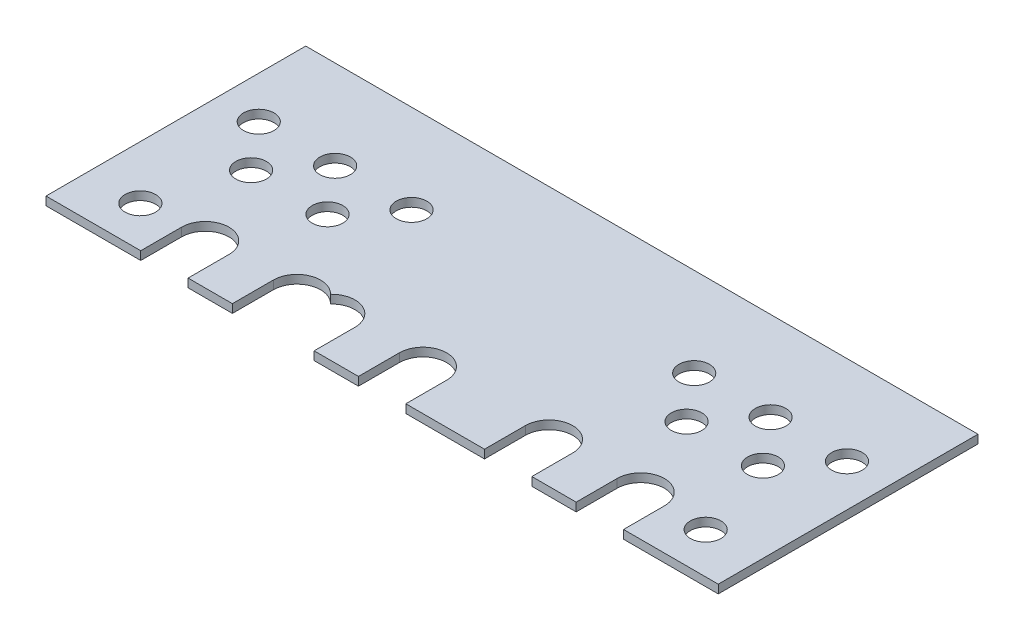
SolidWorks part; units mm, degrees
ref_plane "Front Plane" through (0, 0, 0) normal (0, 0, 1) x (1, 0, 0)
ref_plane "Top Plane" through (0, 0, 0) normal (0, 1, 0) x (1, 0, 0)
ref_plane "Right Plane" through (0, 0, 0) normal (1, 0, 0) x (0, 0, -1)
sketch "Sketch1" plane through (0, 0, 0) normal (0, 1, 0) x (1, 0, 0)
  line L1 (44, -17) -> (-44, -17)
  line L2 (44, -17) -> (44, 17)
  line L3 (44, 17) -> (-44, 17)
  line L4 (-44, -17) -> (-44, 17)
  line L5 (44, -17) -> (-44, 17) construction
  line L6 (44, 17) -> (-44, -17) construction
  point P0 (0, 0)
  dimension "D1" = 88
  dimension "D2" = 34
extrude "Boss-Extrude1" add sketch "Sketch1" along normal blind 1.11
sketch "Sketch2" plane through (0, 1.11, 0) normal (0, 1, 0) x (1, 0, 0)
  line L0 (-44, 5.35) -> (44, 5.35) construction
  line L1 (-44, 17) -> (-44, -17) construction
  line L2 (44, -17) -> (44, 17) construction
  line L3 (44, -0.65) -> (-44, -0.65) construction
  line L4 (-44, -17) -> (44, -17) construction
  line L5 (-33.5, -0.65) -> (-33.5, 5.35) construction
  line L6 (-38.5, 5.35) -> (-28.5, 5.35) construction
  line L7 (28.5, 5.35) -> (38.5, 5.35) construction
  line L8 (33.5, 5.35) -> (33.5, -0.65) construction
  circle A0 centre (-38.5, 5.35) radius 2
  circle A1 centre (-28.5, 5.35) radius 2
  circle A2 centre (-18.5, 5.35) radius 2
  circle A3 centre (-33.5, -0.65) radius 2
  circle A4 centre (-23.5, -0.65) radius 2
  circle A6 centre (18.5, 5.35) radius 2
  circle A7 centre (28.5, 5.35) radius 2
  circle A8 centre (38.5, 5.35) radius 2
  circle A9 centre (23.5, -0.65) radius 2
  circle A10 centre (33.5, -0.65) radius 2
  dimension "D1" = 4
  dimension "D2" = 4
  dimension "D3" = 4
  dimension "D4" = 4
  dimension "D5" = 4
  dimension "D6" = 4
  dimension "D7" = 4
  dimension "D8" = 4
  dimension "D9" = 4
  dimension "D10" = 4
  dimension "D11" = 6
  dimension "D12" = 10
  dimension "D13" = 10
  dimension "D14" = 10
  dimension "D15" = 10
  dimension "D16" = 10
  dimension "D17" = 10
  dimension "D18" = 10.5
  dimension "D19" = 10.5
  dimension "D20" = 16.35
extrude "Cut-Extrude1" cut sketch "Sketch2" against normal through all
sketch "Sketch3" plane through (0, 1.11, 0) normal (0, 1, 0) x (1, 0, 0)
  line L0 (44, -17) -> (44, 17) construction
  line L1 (-44, 17) -> (-44, -17) construction
  line L2 (-44, -17) -> (44, -17) construction
  circle A0 centre (-37, -11.65) radius 2
  circle A1 centre (37, -11.65) radius 2
  dimension "D1" = 4
  dimension "D2" = 4
  dimension "D3" = 7
  dimension "D4" = 7
  dimension "D5" = 5.35
  dimension "D6" = 5.35
extrude "Cut-Extrude2" cut sketch "Sketch3" against normal through all
sketch "Sketch4" plane through (0, 1.11, 0) normal (0, 1, 0) x (1, 0, 0)
  line L0 (-31.6, -11.65) -> (-31.6, -17)
  line L1 (-44, -17) -> (44, -17) construction
  line L2 (-31.6, -17) -> (-25.4, -17)
  line L3 (-25.4, -17) -> (-25.4, -11.65)
  line L4 (-19.6, -11.65) -> (-19.6, -17)
  line L5 (-19.6, -17) -> (-8.9, -17)
  line L6 (-8.9, -11.65) -> (-8.9, -17)
  line L7 (13.4, -11.65) -> (13.4, -17)
  line L8 (13.4, -17) -> (19.6, -17)
  line L9 (19.6, -17) -> (19.6, -11.65)
  line L10 (25.4, -11.65) -> (25.4, -17)
  line L11 (25.4, -17) -> (31.6, -17)
  line L12 (31.6, -17) -> (31.6, -11.65)
  line L13 (-3.1, -11.65) -> (-3.1, -17)
  line L14 (-3.1, -17) -> (3.1, -17)
  line L15 (3.1, -17) -> (3.1, -11.65)
  line L16 (44, -17) -> (44, 17) construction
  line L17 (-44, -11.65) -> (44, -11.65) construction
  line L18 (-44, 17) -> (-44, -17) construction
  arc A0 (-25.4, -11.65) -> (-31.6, -11.65) centre (-28.5, -11.65) ccw
  arc A1 (-14.25, -9.5175) -> (-19.6, -11.65) centre (-16.5, -11.65) ccw
  arc A2 (19.6, -11.65) -> (13.4, -11.65) centre (16.5, -11.65) ccw
  arc A3 (31.6, -11.65) -> (25.4, -11.65) centre (28.5, -11.65) ccw
  arc A4 (3.1, -11.65) -> (-3.1, -11.65) centre (0, -11.65) ccw
  arc A5 (-14.25, -9.5175) -> (-8.9, -11.65) centre (-12, -11.65) cw
  dimension "D2" = 3.1
  dimension "D10" = 3.1
  dimension "D1" = 6.2
  dimension "D3" = 6.2
  dimension "D4" = 6.2
  dimension "D5" = 6.2
  dimension "D6" = 15.5
  dimension "D7" = 27.5
  dimension "D8" = 44
  dimension "D9" = 72.5
  dimension "D11" = 56
  dimension "D12" = 60.5
  dimension "D13" = 5.35
extrude "Cut-Extrude3" cut sketch "Sketch4" against normal through all
